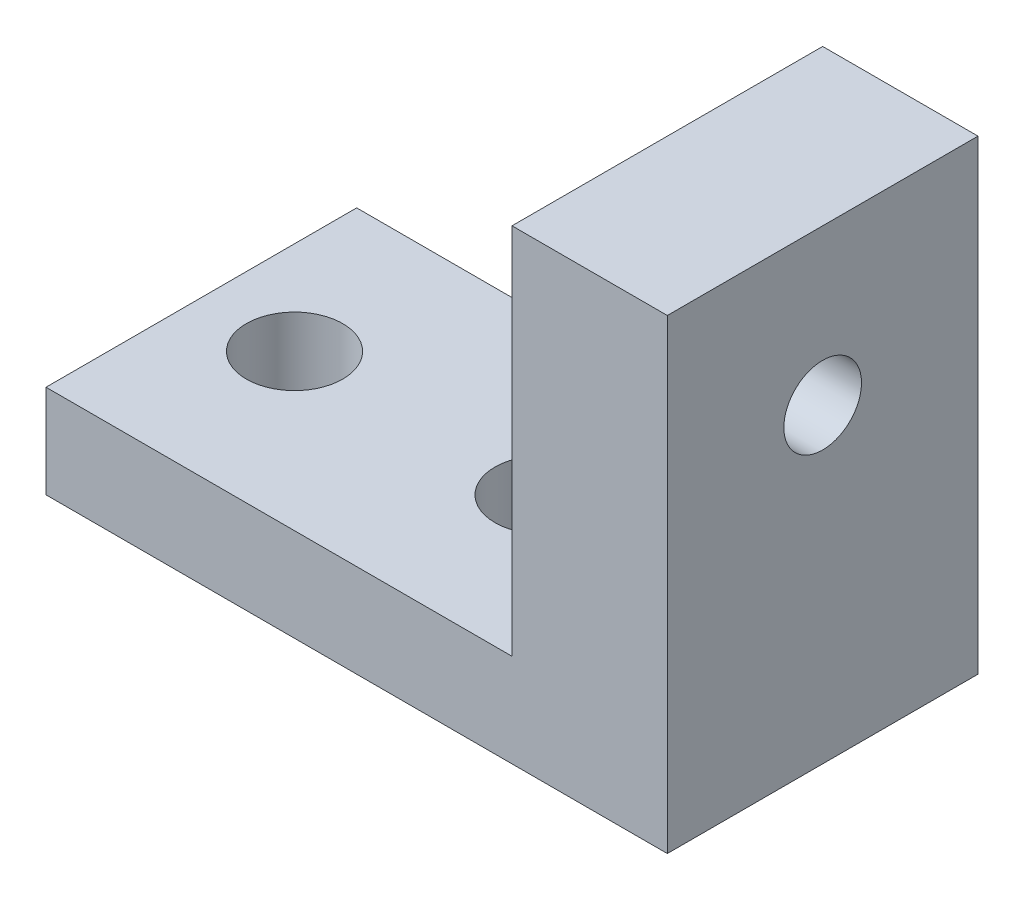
SolidWorks part; units mm, degrees
ref_plane "Front Plane" through (0, 0, 0) normal (0, 0, 1) x (1, 0, 0)
ref_plane "Top Plane" through (0, 0, 0) normal (0, 1, 0) x (1, 0, 0)
ref_plane "Right Plane" through (0, 0, 0) normal (1, 0, 0) x (0, 0, -1)
sketch "Sketch1" plane through (0, 0, 0) normal (1, 0, 0) x (0, 0, -1)
  line L1 (0, 0) -> (10, 0)
  line L2 (0, 0) -> (0, 15)
  line L3 (0, 15) -> (10, 15)
  line L4 (10, 0) -> (10, 15)
  dimension "D1" = 15
  dimension "D2" = 10
extrude "Boss-Extrude1" add sketch "Sketch1" along normal blind 20
hole_wizard "M3x0.5 Tapped Hole1" positions "Sketch3" profile "Sketch2" tap size "M3x0.5" standard "ANSI Metric"
sketch "Sketch3" plane through (20, 0, 0) normal (1, 0, 0) x (0, 0, -1)
  line L0 (0, 0) -> (10, 0) construction
  line L1 (10, 0) -> (10, 15) construction
  point P0 (5, 10)
  dimension "D1" = 10
  dimension "D2" = 5
sketch "Sketch2" plane through (20, 10, -5) normal (0, 1, 0) x (0, 0, -1)
  line L0 (0, 0) -> (0, 8.2511)
  line L1 (0, 8.2511) -> (1.25, 7.5)
  line L2 (1.25, 7.5) -> (1.25, 0)
  line L5 (1.25, 0) -> (0, 0)
  line L10 (0, 8.2511) -> (-1.25, 7.5) construction
  line L11 (0, -6.35) -> (0, 107.95) construction
  dimension "Tap Drill Dia." = 2.5
  dimension "Tap Drill Depth" = 7.5
  dimension "Drill Angle" = 118
sketch "Sketch6" plane through (0, 0, 0) normal (0, 0, 1) x (1, 0, 0)
  line L0 (0, 15) -> (0, 0) construction
  line L1 (0, 3) -> (15, 3)
  line L2 (0, 3) -> (0, 15)
  line L3 (0, 15) -> (15, 15)
  line L4 (15, 3) -> (15, 15)
  line L5 (20, 15) -> (0, 15) construction
  line L6 (20, 15) -> (20, 0) construction
  line L7 (20, 0) -> (0, 0) construction
  dimension "D1" = 5
  dimension "D2" = 3
extrude "Cut-Extrude1" cut sketch "Sketch6" against normal through all
hole_wizard "Ø3.1 (3.1) Diameter Hole1" positions "Sketch9" profile "Sketch7" hole size "Ø3.1" standard "ANSI Metric"
sketch "Sketch9" plane through (0, 3, 0) normal (0, 1, 0) x (1, 0, 0)
  line L0 (3, 5) -> (11, 5) construction
  line L1 (11, 5) -> (11, 10) construction
  line L2 (0, 10) -> (15, 10) construction
  line L4 (11, 5) -> (11, 0) construction
  line L5 (0, 0) -> (15, 0) construction
  line L7 (0, 10) -> (0, 0) construction
  point P0 (3, 5)
  point P2 (11, 5)
  dimension "D1" = 8
  dimension "D2" = 3
sketch "Sketch7" plane through (3, 3, -5) normal (1, 0, 0) x (0, 0, 1)
  line L0 (0, 0) -> (0, 3)
  line L1 (0, 3) -> (1.55, 3)
  line L2 (1.55, 3) -> (1.55, 0)
  line L5 (1.55, 0) -> (0, 0)
  line L11 (0, -6.35) -> (0, 107.95) construction
  dimension "Thru Hole Dia." = 3.1
  dimension "Thru Hole Depth" = 3
